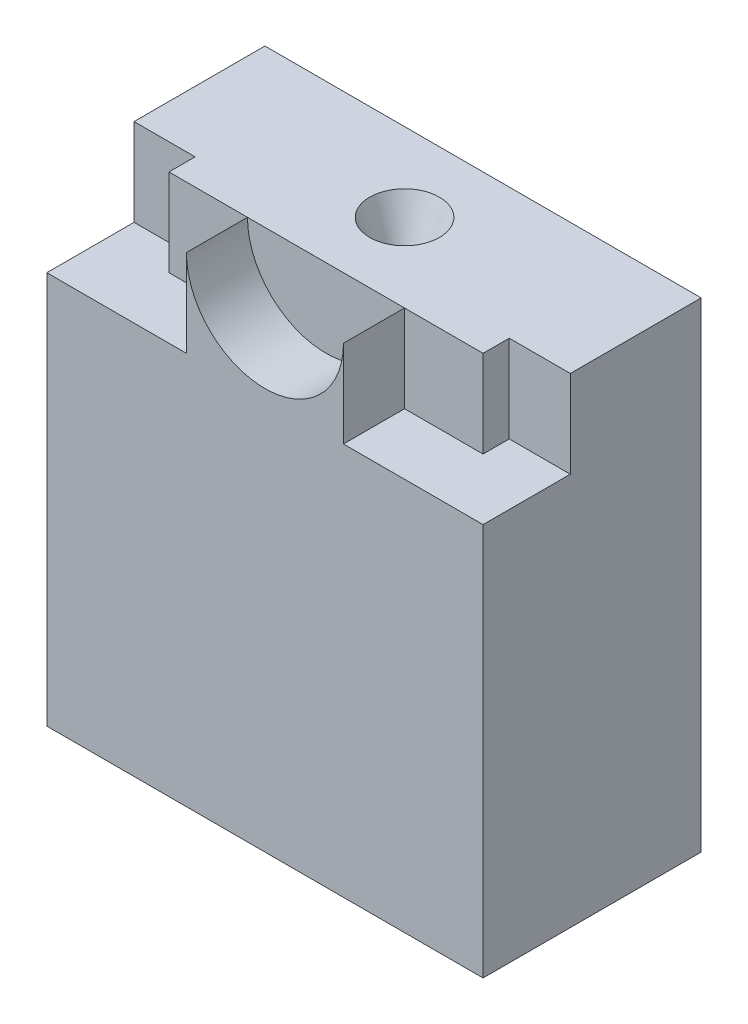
SolidWorks part; units mm, degrees
ref_plane "前视基准面" through (0, 0, 0) normal (0, 0, 1) x (1, 0, 0)
ref_plane "上视基准面" through (0, 0, 0) normal (0, 1, 0) x (1, 0, 0)
ref_plane "右视基准面" through (0, 0, 0) normal (1, 0, 0) x (0, 0, -1)
sketch "草图1" plane through (0, 0, 0) normal (0, 1, 0) x (1, 0, 0)
  line L0 (0, 0) -> (80.8939, 0) construction
  line L1 (80.8939, 0) -> (0, 0) construction
  line L2 (0, 0) -> (0, 69.8629) construction
  line L4 (-25, 12.5) -> (25, 12.5)
  line L5 (-25, 12.5) -> (-25, -12.5)
  line L6 (-25, -12.5) -> (25, -12.5)
  line L7 (25, 12.5) -> (25, -12.5)
extrude "拉伸1" add sketch "草图1" along normal blind 55
sketch "草图4" plane through (0, 55, 0) normal (0, 1, 0) x (1, 0, 0)
  line L0 (-9, -5.5) -> (-18, -5.5)
  line L2 (-18, -5.5) -> (-18, -2.5)
  line L3 (-18, -2.5) -> (-25, -2.5)
  line L4 (-25, 12.5) -> (-25, -12.5) construction
  line L5 (-25, -2.5) -> (-25, -12.5)
  line L6 (-25, -12.5) -> (-9, -12.5)
  line L7 (-9, -12.5) -> (-9, -5.5)
  line L8 (0, 0) -> (0, -17.9598) construction
  line L9 (9, -12.5) -> (9, -5.5)
  line L10 (25, -12.5) -> (9, -12.5)
  line L11 (25, -2.5) -> (25, -12.5)
  line L12 (18, -2.5) -> (25, -2.5)
  line L13 (18, -5.5) -> (18, -2.5)
  line L14 (9, -5.5) -> (18, -5.5)
extrude "切除-拉伸3" cut sketch "草图4" against normal blind 10
sketch "草图5" plane through (0, 0, 0) normal (1, 0, 0) x (0, 0, -1)
  line L0 (3.5, 4.0927) -> (3.5, 59.0885) construction
  line L1 (-12.5, 45) -> (-12.5, 55) construction
  line L2 (3.5, 55) -> (-0.5, 55)
  line L3 (-2.5, 55) -> (12.5, 55) construction
  line L4 (-0.5, 55) -> (3.5, 45.5594)
  line L5 (3.5, 45.5594) -> (3.5, 55)
  dimension "D1" = 16
revolve "切除-旋转1" cut sketch "草图5" angle 360 about L0
sketch "草图6" plane through (0, 55, 0) normal (0, 1, 0) x (1, 0, 0)
  line L0 (0, 0) -> (0, -22.0307) construction
  line L1 (0, -5.5) -> (0, -12.5)
  line L2 (0, -5.5) -> (9, -5.5)
  line L4 (0, -12.5) -> (9, -12.5)
  line L5 (9, -5.5) -> (9, -12.5)
revolve "切除-旋转2" cut sketch "草图6" angle 360 about L0
